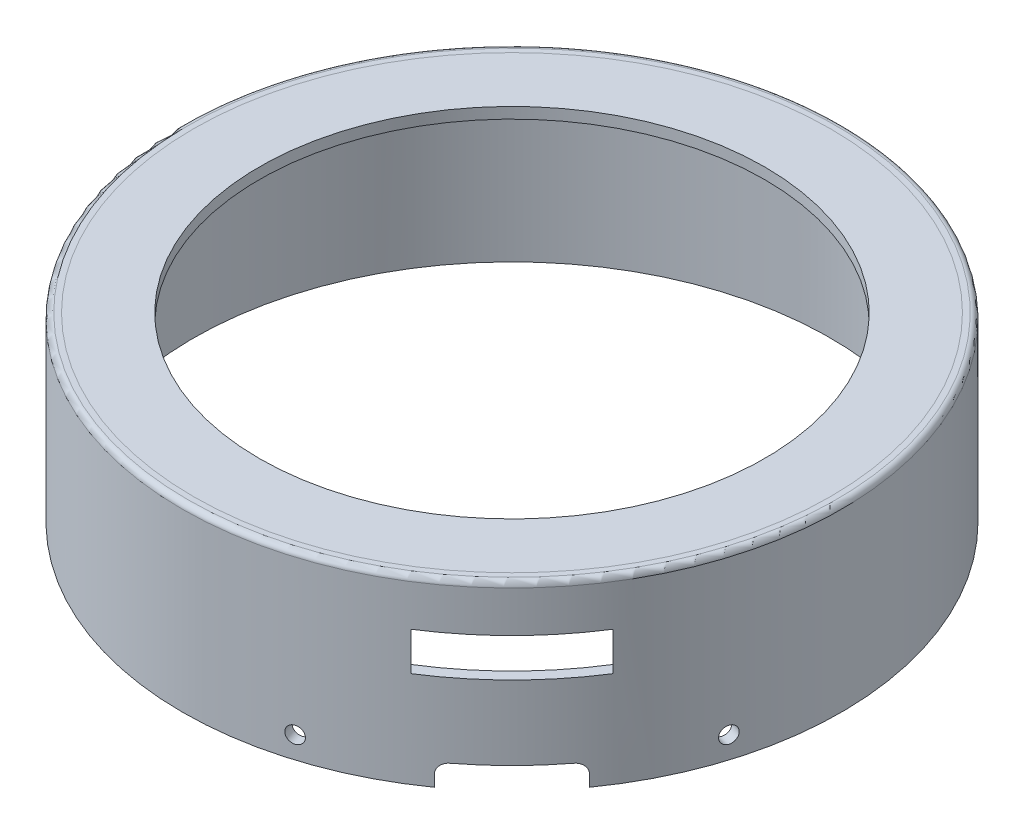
SolidWorks part; units mm, degrees
ref_plane "前视基准面" through (0, 0, 0) normal (0, 0, 1) x (1, 0, 0)
ref_plane "上视基准面" through (0, 0, 0) normal (0, 1, 0) x (1, 0, 0)
ref_plane "右视基准面" through (0, 0, 0) normal (1, 0, 0) x (0, 0, -1)
sketch "草图1" plane through (0, 0, 0) normal (0, 1, 0) x (1, 0, 0)
  circle A0 centre (0, 0) radius 58
  circle A1 centre (0, 0) radius 46
  dimension "D1" = 116
  dimension "D2" = 92
extrude "凸台-拉伸1" add sketch "草图1" along normal blind 2
sketch "草图2" plane through (0, 2, 0) normal (0, 1, 0) x (1, 0, 0)
  circle A0 centre (0, 0) radius 60
  circle A1 centre (0, 0) radius 58
  circle A2 centre (0, 0) radius 58
  dimension "D2" = 120
  dimension "D1" = 0
extrude "凸台-拉伸3" add sketch "草图2" against normal blind 33 separate body
sketch "草图9" plane through (0, 0, 0) normal (0, -1, 0) x (1, 0, 0)
  line L0 (-70.258, 13.4292) -> (-40.1291, -51.1826) construction
  line L1 (-87.3207, -23.2776) -> (-15.691, -56.6791) construction
  line L2 (0, 0) -> (-81.2838, 0) construction
  line L3 (0, 0) -> (0, -68.3259) construction
  line L4 (-45.8838, 74.9866) -> (60.9796, 41.7918) construction
  line L5 (42.935, 57.2993) -> (45.481, 49.103) construction
  line L6 (0, 0) -> (74.1735, 74.1735) construction
  line L7 (17.3027, 64.7217) -> (73.0685, 8.9559) construction
  circle A0 centre (0, 0) radius 58 construction
  circle A2 centre (0, 0) radius 58 construction
  point P17 (46.3394, 46.3394)
  point P20 (17.2055, 55.3893)
  dimension "D1" = 65
  dimension "D2" = 65
  dimension "D3" = 45
  dimension "D4" = 27
ref_plane "基准面6" through (-52.5659, 0, -24.5119) normal (-0.9063, 0, -0.4226) x (0.4226, 0, -0.9063)
ref_plane "基准面7" through (-24.5119, 0, -52.5659) normal (-0.4226, 0, -0.9063) x (0.9063, 0, -0.4226)
fillet "圆角1" radius 1 1 edges at (0, 2, 60)
sketch "草图10" plane through (-52.5659, 0, -24.5119) normal (-0.9063, 0, -0.4226) x (0.4226, 0, -0.9063)
  line L0 (-181261.5574, 0) -> (181323.4817, 0) construction
  circle A0 centre (0, 7) radius 1.5
  dimension "D1" = 3
  dimension "D2" = 7
extrude "切除-拉伸1" cut sketch "草图10" against normal up to next and the other way up to next
sketch "草图11" plane through (-24.5119, 0, -52.5659) normal (-0.4226, 0, -0.9063) x (0.9063, 0, -0.4226)
  line L0 (-84523.6523, 0) -> (84552.5281, 0) construction
  circle A0 centre (0, 7) radius 1.5
  dimension "D1" = 3
  dimension "D2" = 7
extrude "切除-拉伸2" cut sketch "草图11" against normal up to next and the other way up to next
ref_plane "基准面8" through (17.2055, 0, 55.3893) normal (-0.2966, 0, -0.955) x (0.955, 0, -0.2966)
ref_plane "基准面9" through (55.3893, 0, 17.2055) normal (-0.955, 0, -0.2966) x (0.2966, 0, -0.955)
sketch "草图13" plane through (17.2055, 0, 55.3893) normal (-0.2966, 0, -0.955) x (0.955, 0, -0.2966)
  line L0 (-113293.4745, 0) -> (113346.3467, 0) construction
  circle A0 centre (0, 27) radius 1.5
  dimension "D1" = 3
  dimension "D2" = 27
extrude "切除-拉伸3" cut sketch "草图13" against normal up to next and the other way up to next
sketch "草图14" plane through (55.3893, 0, 17.2055) normal (-0.955, 0, -0.2966) x (0.2966, 0, -0.955)
  line L0 (-113402.7017, 0) -> (113295.658, 0) construction
  circle A0 centre (0, 27) radius 1.5
  dimension "D1" = 3
  dimension "D2" = 27
extrude "切除-拉伸4" cut sketch "草图14" against normal up to next and the other way up to next
ref_plane "基准面10" through (41.0122, 0, 41.0122) normal (-0.7071, 0, -0.7071) x (0.7071, 0, -0.7071)
sketch "草图15" plane through (41.0122, 0, 41.0122) normal (-0.7071, 0, -0.7071) x (0.7071, 0, -0.7071)
  line L0 (-177093.2306, 0) -> (177021.3301, 0) construction
  line L3 (58, 31) -> (-58, 31) construction
  line L4 (-10, 35) -> (10, 35)
  line L5 (-13, 13.5) -> (13, 13.5)
  line L6 (-13, 13.5) -> (-13, 6.5)
  line L7 (-13, 6.5) -> (13, 6.5)
  line L8 (13, 13.5) -> (13, 6.5)
  line L9 (-13, 13.5) -> (13, 6.5) construction
  line L10 (-13, 6.5) -> (13, 13.5) construction
  line L11 (-10, 35) -> (-10, 29)
  line L12 (-8, 27) -> (8, 27)
  line L13 (10, 35) -> (10, 29)
  line L14 (-10, 35) -> (10, 27) construction
  line L15 (-10, 27) -> (10, 35) construction
  arc A0 (8, 27) -> (10, 29) centre (8, 29) ccw
  arc A1 (-10, 29) -> (-8, 27) centre (-8, 29) ccw
  point P0 (0, 10)
  point P7 (0, 31)
  dimension "D6" = 2
  dimension "D1" = 26
  dimension "D2" = 7
  dimension "D3" = 10
  dimension "D4" = 8
  dimension "D5" = 20
extrude "切除-拉伸5" cut sketch "草图15" against normal up to next and the other way up to next
